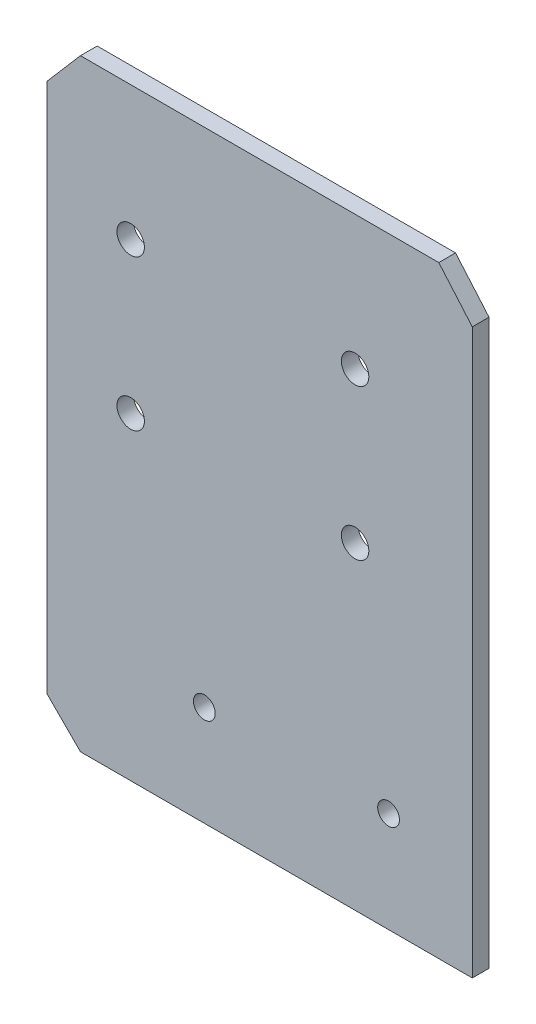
SolidWorks part; units mm, degrees
ref_plane "Plan de face" through (0, 0, 0) normal (0, 0, 1) x (1, 0, 0)
ref_plane "Plan de dessus" through (0, 0, 0) normal (0, 1, 0) x (1, 0, 0)
ref_plane "Plan de droite" through (0, 0, 0) normal (1, 0, 0) x (0, 0, -1)
sketch "Esquisse1" plane through (0, 0, 0) normal (0, 0, 1) x (1, 0, 0)
  line L0 (-19.2542, -3.26) -> (-19.2542, 165.115)
  line L1 (-19.2542, -3.26) -> (-136.2542, -3.26)
  line L2 (-29.2542, 176.74) -> (-136.2542, 176.74)
  line L4 (-19.2542, 165.115) -> (-29.2542, 176.74)
  line L6 (-136.2542, 176.74) -> (-146.2542, 165.115)
  line L7 (-146.2542, 165.115) -> (-145.9189, 165.0937)
  line L8 (-136.2542, -3.26) -> (-146.2542, 6.74)
  line L9 (-146.2542, 6.74) -> (-146.2542, 165.115)
  circle A0 centre (-121.2542, 136.74) radius 4.1
  circle A1 centre (-54.2542, 136.74) radius 4.1
  circle A2 centre (-54.2542, 91.74) radius 4.1
  circle A3 centre (-121.2542, 91.74) radius 4.1
  circle A4 centre (-99.2542, 26.74) radius 3.25
  circle A5 centre (-44.2542, 26.74) radius 3.25
  dimension "D5" = 8.2
  dimension "D6" = 8.2
  dimension "D7" = 8.2
  dimension "D8" = 8.2
  dimension "D9" = 40
  dimension "D10" = 45
  dimension "D11" = 25
  dimension "D12" = 67
  dimension "D13" = 67
  dimension "D14" = 45
  dimension "D15" = 40
  dimension "D16" = 6.5
  dimension "D17" = 6.5
  dimension "D18" = 25
  dimension "D19" = 30
  dimension "D20" = 30
  dimension "D21" = 55
  dimension "D1" = 168.375
  dimension "D2" = 117
  dimension "D3" = 107
  dimension "D4" = 180
extrude "Extrusion1" add sketch "Esquisse1" along normal blind 5
